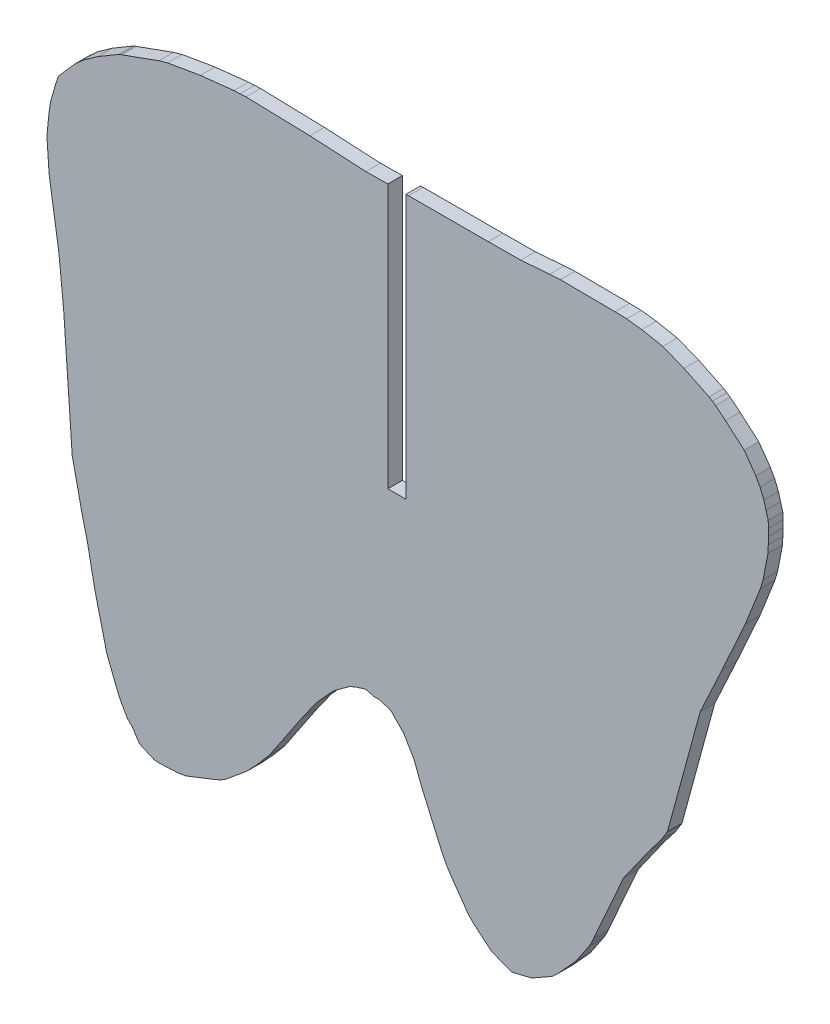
SolidWorks part; units mm, degrees
ref_plane "Спереди" through (0, 0, 0) normal (0, 0, 1) x (1, 0, 0)
ref_plane "Сверху" through (0, 0, 0) normal (0, 1, 0) x (1, 0, 0)
ref_plane "Справа" through (0, 0, 0) normal (1, 0, 0) x (0, 0, -1)
sketch "Model" plane through (0, 0, 0) normal (0, 0, 1) x (1, 0, 0)
  line L0 (-6154.0155, 147.3107) -> (-6153.9786, 148.3382)
  line L1 (-6153.9786, 148.3382) -> (-6154.0006, 149.2709)
  line L2 (-6154.0006, 149.2709) -> (-6154.0227, 150.2036)
  line L3 (-6154.0227, 150.2036) -> (-6154.3248, 151.2813)
  line L4 (-6154.3248, 151.2813) -> (-6154.627, 152.359)
  line L5 (-6154.627, 152.359) -> (-6155.1529, 153.6331)
  line L6 (-6155.1529, 153.6331) -> (-6155.7398, 154.6803)
  line L7 (-6155.7398, 154.6803) -> (-6157.3282, 156.9238)
  line L8 (-6157.3282, 156.9238) -> (-6159.8905, 159.1452)
  line L9 (-6159.8905, 159.1452) -> (-6161.2616, 160.2672)
  line L10 (-6161.2616, 160.2672) -> (-6161.712, 160.5626)
  line L11 (-6161.712, 160.5626) -> (-6162.1623, 160.8581)
  line L12 (-6162.1623, 160.8581) -> (-6165.6062, 162.5244)
  line L13 (-6165.6062, 162.5244) -> (-6168.5288, 163.6722)
  line L14 (-6168.5288, 163.6722) -> (-6171.4089, 164.2268)
  line L15 (-6171.4089, 164.2268) -> (-6173.4835, 164.478)
  line L16 (-6173.4835, 164.478) -> (-6175.0912, 164.5199)
  line L17 (-6175.0912, 164.5199) -> (-6182.5921, 164.5797)
  line L18 (-6182.5921, 164.5797) -> (-6184.0721, 164.4899)
  line L19 (-6184.0721, 164.4899) -> (-6188.0426, 164.1824)
  line L20 (-6188.0426, 164.1824) -> (-6192.5081, 164.1544)
  line L21 (-6192.5081, 164.1544) -> (-6203.4691, 164.1391)
  line L22 (-6203.4691, 164.1391) -> (-6203.822, 164.1358)
  line L23 (-6203.822, 164.1358) -> (-6203.822, 127.8223)
  line L24 (-6203.822, 127.8223) -> (-6204.072, 127.8223)
  line L25 (-6204.072, 127.8223) -> (-6206.072, 127.8223)
  line L26 (-6206.072, 127.8223) -> (-6206.322, 127.8223)
  line L27 (-6206.322, 127.8223) -> (-6206.322, 164.1123)
  line L28 (-6206.322, 164.1123) -> (-6209.3314, 164.084)
  line L29 (-6209.3314, 164.084) -> (-6217.0414, 164.4924)
  line L30 (-6217.0414, 164.4924) -> (-6225.8253, 164.733)
  line L31 (-6225.8253, 164.733) -> (-6226.6393, 164.6966)
  line L32 (-6226.6393, 164.6966) -> (-6227.4737, 164.6607)
  line L33 (-6227.4737, 164.6607) -> (-6232.0853, 164.158)
  line L34 (-6232.0853, 164.158) -> (-6236.5897, 163.3913)
  line L35 (-6236.5897, 163.3913) -> (-6237.7896, 163.0485)
  line L36 (-6237.7896, 163.0485) -> (-6242.8884, 161.2083)
  line L37 (-6242.8884, 161.2083) -> (-6243.0811, 161.1346)
  line L38 (-6243.0811, 161.1346) -> (-6243.274, 161.0609)
  line L39 (-6243.274, 161.0609) -> (-6243.3341, 161.0323)
  line L40 (-6243.3341, 161.0323) -> (-6246.2064, 159.3331)
  line L41 (-6246.2064, 159.3331) -> (-6248.2147, 157.9072)
  line L42 (-6248.2147, 157.9072) -> (-6249.398, 156.8311)
  line L43 (-6249.398, 156.8311) -> (-6251.5172, 154.4147)
  line L44 (-6251.5172, 154.4147) -> (-6251.589, 154.2861)
  line L45 (-6251.589, 154.2861) -> (-6251.6609, 154.1575)
  line L46 (-6251.6609, 154.1575) -> (-6251.8158, 153.6917)
  line L47 (-6251.8158, 153.6917) -> (-6251.9706, 153.226)
  line L48 (-6251.9706, 153.226) -> (-6252.7059, 150.6364)
  line L49 (-6252.7059, 150.6364) -> (-6252.8126, 149.8839)
  line L50 (-6252.8126, 149.8839) -> (-6252.9194, 149.1313)
  line L51 (-6252.9194, 149.1313) -> (-6253.1862, 146.377)
  line L52 (-6253.1862, 146.377) -> (-6252.8824, 141.9964)
  line L53 (-6252.8824, 141.9964) -> (-6251.524, 133.1949)
  line L54 (-6251.524, 133.1949) -> (-6250.873, 126.6863)
  line L55 (-6250.873, 126.6863) -> (-6249.7071, 110.0764)
  line L56 (-6249.7071, 110.0764) -> (-6248.316, 103.6791)
  line L57 (-6248.316, 103.6791) -> (-6247.6264, 100.8887)
  line L58 (-6247.6264, 100.8887) -> (-6246.5821, 95.5914)
  line L59 (-6246.5821, 95.5914) -> (-6244.9372, 88.8372)
  line L60 (-6244.9372, 88.8372) -> (-6243.5451, 85.3187)
  line L61 (-6243.5451, 85.3187) -> (-6243.2999, 84.76)
  line L62 (-6243.2999, 84.76) -> (-6243.0548, 84.2012)
  line L63 (-6243.0548, 84.2012) -> (-6242.5921, 83.4012)
  line L64 (-6242.5921, 83.4012) -> (-6242.1296, 82.6011)
  line L65 (-6242.1296, 82.6011) -> (-6241.4365, 81.9056)
  line L66 (-6241.4365, 81.9056) -> (-6240.4558, 80.3795)
  line L67 (-6240.4558, 80.3795) -> (-6238.3983, 79.4847)
  line L68 (-6238.3983, 79.4847) -> (-6237.6107, 79.4494)
  line L69 (-6237.6107, 79.4494) -> (-6235.1811, 79.5682)
  line L70 (-6235.1811, 79.5682) -> (-6234.0628, 79.762)
  line L71 (-6234.0628, 79.762) -> (-6229.9234, 81.3853)
  line L72 (-6229.9234, 81.3853) -> (-6229.2074, 81.7188)
  line L73 (-6229.2074, 81.7188) -> (-6228.6725, 82.045)
  line L74 (-6228.6725, 82.045) -> (-6225.6853, 84.5183)
  line L75 (-6225.6853, 84.5183) -> (-6224.186, 86.1146)
  line L76 (-6224.186, 86.1146) -> (-6222.5407, 88.0587)
  line L77 (-6222.5407, 88.0587) -> (-6217.9764, 94.8635)
  line L78 (-6217.9764, 94.8635) -> (-6216.0777, 97.5102)
  line L79 (-6216.0777, 97.5102) -> (-6214.2765, 99.5002)
  line L80 (-6214.2765, 99.5002) -> (-6213.9505, 99.8283)
  line L81 (-6213.9505, 99.8283) -> (-6213.6247, 100.1564)
  line L82 (-6213.6247, 100.1564) -> (-6211.6545, 101.5873)
  line L83 (-6211.6545, 101.5873) -> (-6211.2418, 101.7911)
  line L84 (-6211.2418, 101.7911) -> (-6210.8289, 101.9949)
  line L85 (-6210.8289, 101.9949) -> (-6209.3736, 102.4271)
  line L86 (-6209.3736, 102.4271) -> (-6208.1681, 102.1304)
  line L87 (-6208.1681, 102.1304) -> (-6207.45, 102.1539)
  line L88 (-6207.45, 102.1539) -> (-6207.1219, 102.0301)
  line L89 (-6207.1219, 102.0301) -> (-6206.7939, 101.9063)
  line L90 (-6206.7939, 101.9063) -> (-6206.2296, 101.7858)
  line L91 (-6206.2296, 101.7858) -> (-6205.7345, 101.4787)
  line L92 (-6205.7345, 101.4787) -> (-6205.356, 101.0573)
  line L93 (-6205.356, 101.0573) -> (-6204.1229, 99.7884)
  line L94 (-6204.1229, 99.7884) -> (-6203.775, 99.1929)
  line L95 (-6203.775, 99.1929) -> (-6202.7293, 97.4183)
  line L96 (-6202.7293, 97.4183) -> (-6201.6593, 94.6303)
  line L97 (-6201.6593, 94.6303) -> (-6198.9002, 88.3298)
  line L98 (-6198.9002, 88.3298) -> (-6198.2528, 87.0506)
  line L99 (-6198.2528, 87.0506) -> (-6197.9356, 86.5573)
  line L100 (-6197.9356, 86.5573) -> (-6197.6186, 86.0639)
  line L101 (-6197.6186, 86.0639) -> (-6195.2071, 82.6354)
  line L102 (-6195.2071, 82.6354) -> (-6194.836, 82.2664)
  line L103 (-6194.836, 82.2664) -> (-6194.4651, 81.8974)
  line L104 (-6194.4651, 81.8974) -> (-6192.0433, 79.8631)
  line L105 (-6192.0433, 79.8631) -> (-6189.3167, 78.8222)
  line L106 (-6189.3167, 78.8222) -> (-6189.2384, 78.8111)
  line L107 (-6189.2384, 78.8111) -> (-6186.836, 79.3912)
  line L108 (-6186.836, 79.3912) -> (-6186.6461, 79.4494)
  line L109 (-6186.6461, 79.4494) -> (-6186.456, 79.5076)
  line L110 (-6186.456, 79.5076) -> (-6184.0407, 80.8813)
  line L111 (-6184.0407, 80.8813) -> (-6183.7829, 81.0062)
  line L112 (-6183.7829, 81.0062) -> (-6182.7904, 81.9431)
  line L113 (-6182.7904, 81.9431) -> (-6180.4496, 84.5356)
  line L114 (-6180.4496, 84.5356) -> (-6178.6602, 87.2004)
  line L115 (-6178.6602, 87.2004) -> (-6178.3287, 87.7568)
  line L116 (-6178.3287, 87.7568) -> (-6178.1576, 88.1345)
  line L117 (-6178.1576, 88.1345) -> (-6177.9863, 88.5123)
  line L118 (-6177.9863, 88.5123) -> (-6173.9011, 97.7038)
  line L119 (-6173.9011, 97.7038) -> (-6170.3692, 102.7006)
  line L120 (-6170.3692, 102.7006) -> (-6168.7713, 104.7708)
  line L121 (-6168.7713, 104.7708) -> (-6167.8822, 106.2028)
  line L122 (-6167.8822, 106.2028) -> (-6163.3753, 122.7467)
  line L123 (-6163.3753, 122.7467) -> (-6160.3479, 129.2778)
  line L124 (-6160.3479, 129.2778) -> (-6157.1707, 136.2986)
  line L125 (-6157.1707, 136.2986) -> (-6155.0881, 141.5758)
  line L126 (-6155.0881, 141.5758) -> (-6154.7314, 142.7786)
  line L127 (-6154.7314, 142.7786) -> (-6154.0525, 146.2833)
  line L128 (-6154.0525, 146.2833) -> (-6154.0155, 147.3107)
extrude "Бобышка-Вытянуть1" add sketch "Model" along normal blind 2
